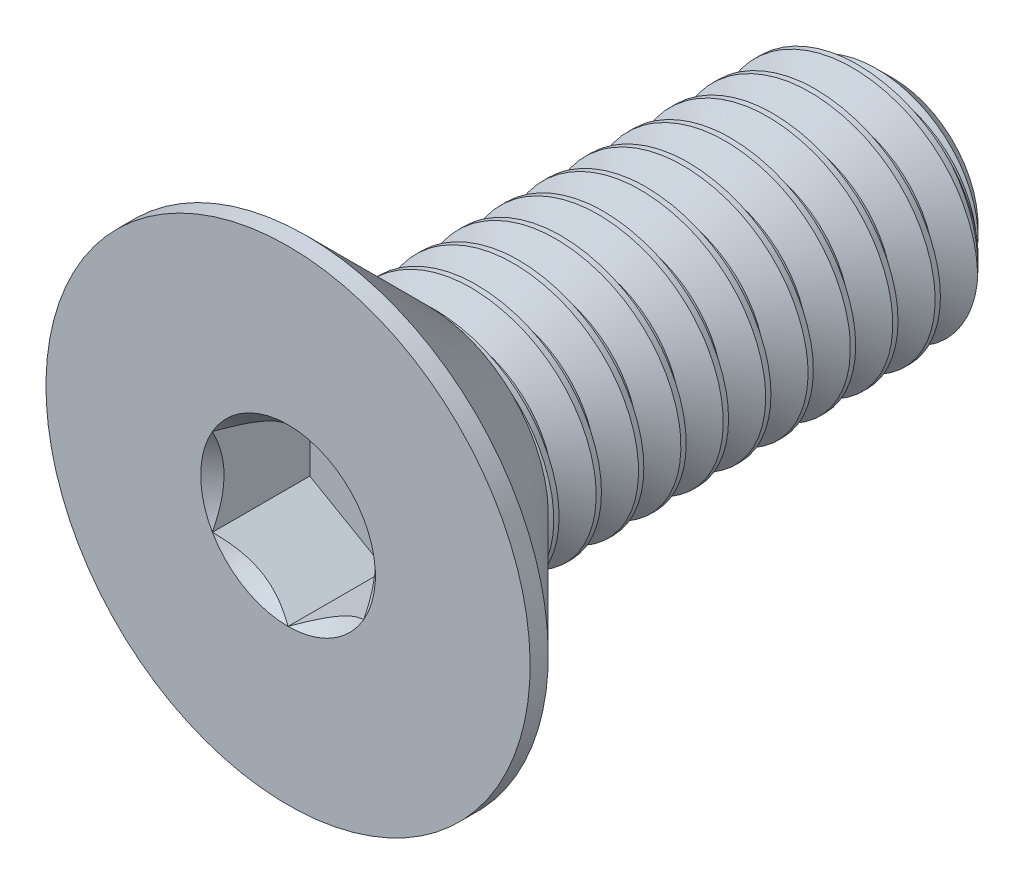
SolidWorks part; units mm, degrees
ref_plane "Front" through (0, 0, 0) normal (0, 0, 1) x (1, 0, 0)
ref_plane "Top" through (0, 0, 0) normal (0, 1, 0) x (1, 0, 0)
ref_plane "Right" through (0, 0, 0) normal (1, 0, 0) x (0, 0, -1)
sketch "Sketch1" plane through (0, 0, 0) normal (1, 0, 0) x (0, 0, -1)
  line L0 (-5, 4) -> (-4.7, 4) construction
  line L1 (-4.7, 4) -> (-2.7, 2) construction
  line L2 (-5, 2) -> (5, 2) construction
  line L3 (5, 2) -> (5, 0) construction
  line L4 (5, 0) -> (-5, 0) construction
  line L5 (-5, 0) -> (-5, 4) construction
  line L6 (-5, 4) -> (-5, -4) construction
  line L7 (5, 2) -> (5, -2) construction
  line L8 (-5, -4) -> (-4.7, -4) construction
  line L9 (-4.7, -4) -> (-2.7, -2) construction
  line L11 (-5, 2) -> (-5, 0) construction
  line L12 (-2.7, 2) -> (-2.7, 0) construction
  line L13 (4.9563, 2.0758) -> (5.3063, 1.4696) construction
  line L14 (5.3063, 1.4696) -> (5.6562, 2.0758) construction
  line L15 (5.6562, 2.0758) -> (4.9563, 2.0758) construction
  line L16 (5.3063, 2.0758) -> (5.3063, 2) construction
  line L17 (5.3063, 2) -> (5.3063, 1.5453) construction
  line L18 (5.3063, 1.5453) -> (5.3063, 1.4696) construction
  line L19 (5.3063, 2.0379) -> (5.6344, 2.0379) construction
  line L20 (5.3063, 2.0379) -> (4.9781, 2.0379) construction
  line L21 (5, 2) -> (5.6125, 2) construction
  line L22 (5.2625, 1.5453) -> (5.35, 1.5453) construction
  line L23 (5, -2) -> (-2.7, -2) construction
  point P10 (3.25, -2)
  point P24 (-2.7, 2)
  point P30 (0, 0)
sketch "Sketch2" plane through (0, 0, 0) normal (0, 0, 1) x (1, 0, 0)
  line L1 (0, 1.4434) -> (-1.25, 0.7217) construction
  line L2 (-1.25, 0.7217) -> (-1.25, -0.7217) construction
  line L3 (-1.25, -0.7217) -> (0, -1.4434) construction
  line L4 (0, -1.4434) -> (1.25, -0.7217) construction
  line L5 (1.25, -0.7217) -> (1.25, 0.7217) construction
  line L6 (1.25, 0.7217) -> (0, 1.4434) construction
  circle A0 centre (0, 0) radius 1.25 construction
  dimension "Drive Size" = 2.5
sketch "Sketch3" plane through (0, 0, 0) normal (1, 0, 0) x (0, 0, -1)
  line L0 (-5, 2) -> (5, 2)
  line L1 (5, 2) -> (5, 0)
  line L2 (5, 0) -> (-5, 0)
  line L3 (-5, 0) -> (-5, 2)
revolve "Revolve1" add sketch "Sketch3" angle 360 about L4
chamfer "Chamfer1" distance 0.6 angle 45 1 edges at (0, 2, -5)
sketch "Sketch6" plane through (0, 0, 0) normal (1, 0, 0) x (0, 0, -1)
  line L0 (-5, 4) -> (-4.7, 4)
  line L1 (-4.7, 4) -> (-2.7, 2)
  line L2 (-2.7, 2) -> (-2.7, 0)
  line L3 (-2.7, 0) -> (-5, 0)
  line L4 (-5, 0) -> (-5, 4)
revolve "Revolve2" add sketch "Sketch6" angle 360 about L4
sketch "Sketch8" plane through (0, 0, 5) normal (0, 0, 1) x (1, 0, 0)
  line L0 (0, 1.4434) -> (-1.25, 0.7217) construction
  line L1 (1.25, 0.7217) -> (0, 1.4434) construction
  line L2 (1.25, -0.7217) -> (1.25, 0.7217) construction
  line L3 (0, -1.4434) -> (1.25, -0.7217) construction
  line L4 (-1.25, 0.7217) -> (-1.25, -0.7217) construction
  line L5 (-1.25, -0.7217) -> (0, -1.4434) construction
  line L6 (0, 1.4434) -> (-1.25, 0.7217)
  line L7 (1.25, 0.7217) -> (0, 1.4434)
  line L8 (1.25, -0.7217) -> (1.25, 0.7217)
  line L9 (0, -1.4434) -> (1.25, -0.7217)
  line L10 (-1.25, 0.7217) -> (-1.25, -0.7217)
  line L11 (-1.25, -0.7217) -> (0, -1.4434)
extrude "Cut-Extrude1" cut sketch "Sketch8" against normal blind 1.61
sketch "Sketch9" plane through (0, 0, 5) normal (0, 0, 1) x (1, 0, 0)
  circle A0 centre (0, 0) radius 1.4434
extrude "Cut-Extrude2" cut sketch "Sketch9" against normal up to next (1.61 mm away) draft 45
ref_plane "Plane1" through (0, 0, 2.7) normal (0, 0, 1) x (1, 0, 0)
split "Split1" trim tools "Plane1" bodies to split 124 resulting bodies 126 127
sketch "Sketch4" plane through (0, 0, -5) normal (0, 0, -1) x (-1, 0, 0)
  circle A0 centre (0, 0) radius 2 construction
  circle A1 centre (0, 0) radius 2
curve "Helix/Spiral1"
sketch "Sketch10" plane through (0, 0, 0) normal (1, 0, 0) x (0, 0, -1)
  line L0 (4.9781, 2.0379) -> (5.6344, 2.0379)
  line L1 (5.6344, 2.0379) -> (5.35, 1.5453)
  line L2 (5.35, 1.5453) -> (5.2625, 1.5453)
  line L3 (5.2625, 1.5453) -> (4.9781, 2.0379)
sweep "Cut-Sweep1" cut profiles "Sketch10" path "Helix/Spiral1"
equation "\"D2@Sketch1\" = \"Thread Pitch@Sketch1\" / 8"
equation "\"D4@Helix/Spiral1\"=\"Thread Pitch@Sketch1\""
equation "\"D3@Helix/Spiral1\"=\"Minimum Thread Length@Sketch1\"+\"Thread Pitch@Sketch1\""
equation "\"D1@Chamfer1\"=\"Thread Size@Sketch1\"*.15"
equation "\"D1@Cut-Extrude1\"=\"Head Height@Sketch1\"*.7"
equation "\"D1@Sketch1\"=\"Thread Pitch@Sketch1\"*2.5"
